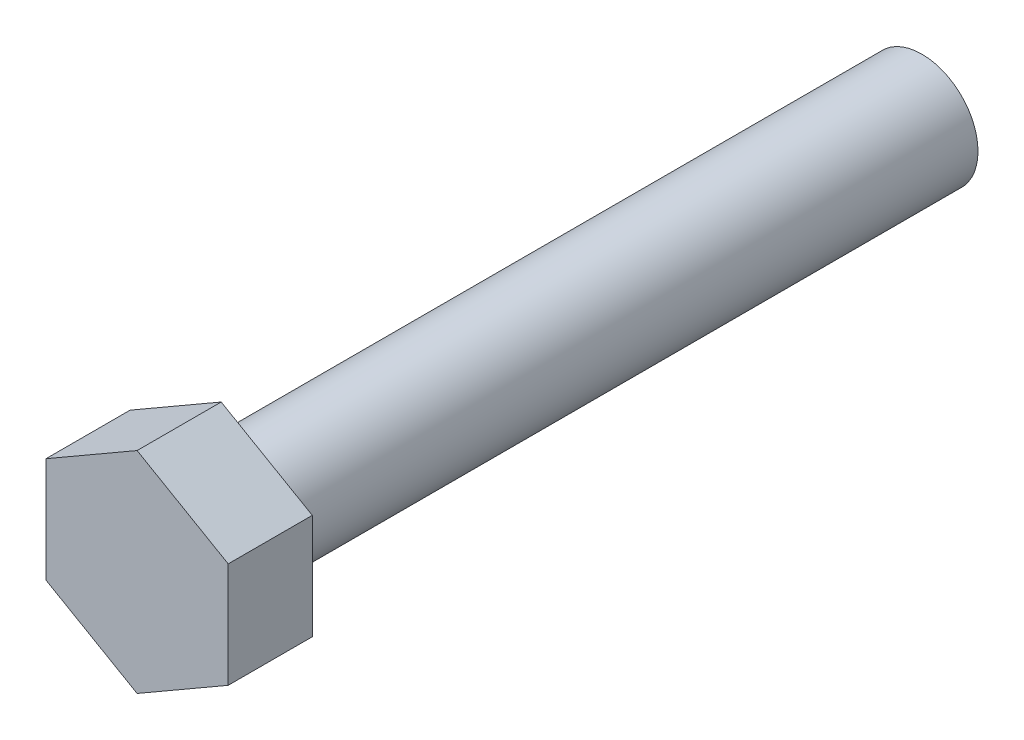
SolidWorks part; units mm, degrees
ref_plane "Front Plane" through (0, 0, 0) normal (0, 0, 1) x (1, 0, 0)
ref_plane "Top Plane" through (0, 0, 0) normal (0, 1, 0) x (1, 0, 0)
ref_plane "Right Plane" through (0, 0, 0) normal (1, 0, 0) x (0, 0, -1)
sketch "Sketch1" plane through (0, 0, 0) normal (0, 0, 1) x (1, 0, 0)
  line L1 (13, 7.5056) -> (0, 15.0111)
  line L2 (0, 15.0111) -> (-13, 7.5056)
  line L3 (-13, 7.5056) -> (-13, -7.5056)
  line L4 (-13, -7.5056) -> (0, -15.0111)
  line L5 (0, -15.0111) -> (13, -7.5056)
  line L6 (13, -7.5056) -> (13, 7.5056)
  circle A0 centre (0, 0) radius 13 construction
  dimension "D1" = 26
extrude "Boss-Extrude1" add sketch "Sketch1" along normal blind 12
sketch "Sketch2" plane through (0, 0, 0) normal (0, 0, -1) x (-1, 0, 0)
  circle A0 centre (0, 0) radius 8
  dimension "D1" = 16
extrude "Boss-Extrude2" add sketch "Sketch2" along normal blind 100
